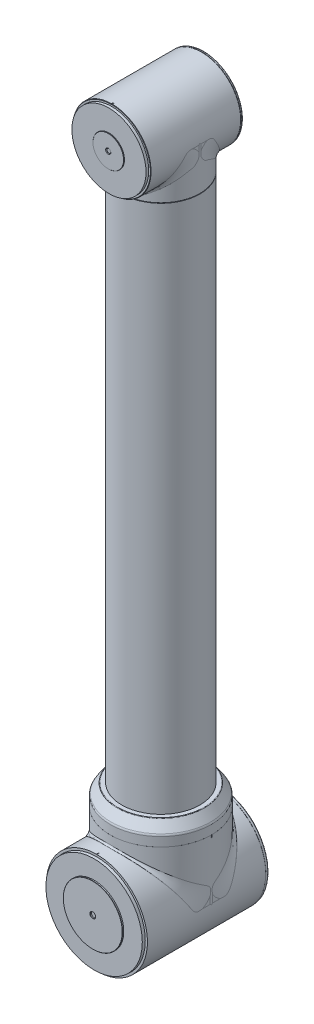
SolidWorks part; units mm, degrees
ref_plane "前视基准面" through (0, 0, 0) normal (0, 0, 1) x (1, 0, 0)
ref_plane "上视基准面" through (0, 0, 0) normal (0, 1, 0) x (1, 0, 0)
ref_plane "右视基准面" through (0, 0, 0) normal (1, 0, 0) x (0, 0, -1)
imported_body "输入1"
ref_plane "基准面1" through (0, -180, 0) normal (0, 1, 0) x (1, 0, 0)
sketch "草图1" plane through (0, -180, 0) normal (0, 1, 0) x (1, 0, 0)
  circle A0 centre (0, 185.3) radius 95.4966
  circle A1 centre (0, 185.3) radius 68.3464
extrude "切除-拉伸1" cut sketch "草图1" along normal blind 0.01
